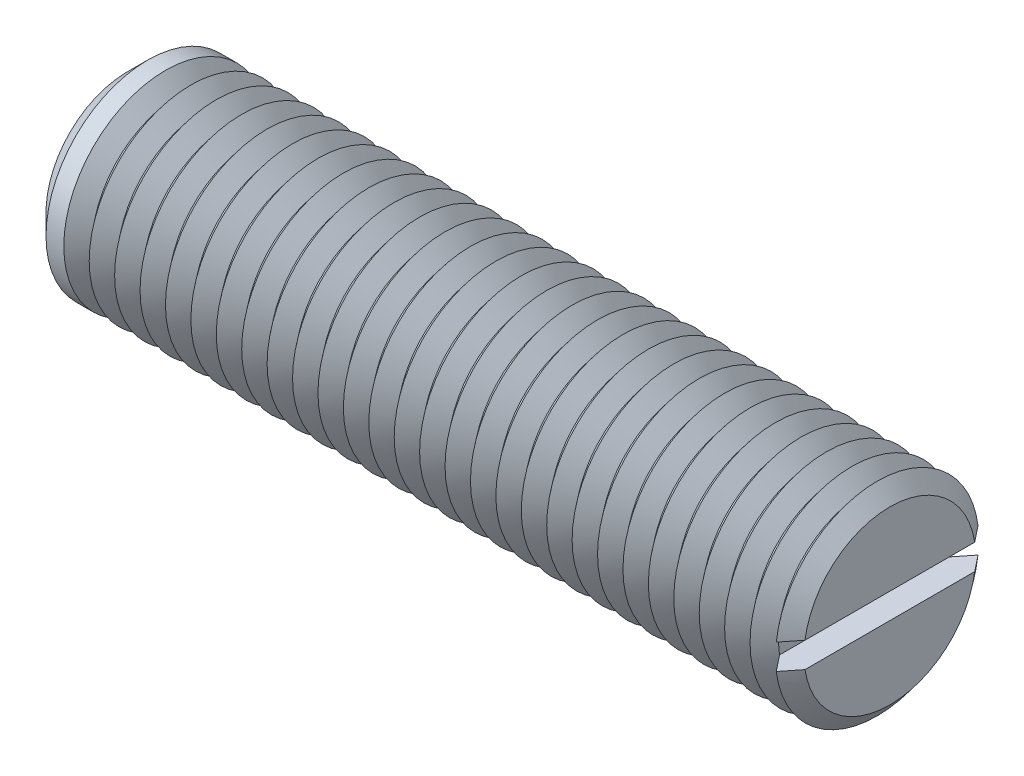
SolidWorks part; units mm, degrees
ref_plane "Front Plane" through (0, 0, 0) normal (0, 0, 1) x (1, 0, 0)
ref_plane "Top Plane" through (0, 0, 0) normal (0, 1, 0) x (1, 0, 0)
ref_plane "Right Plane" through (0, 0, 0) normal (1, 0, 0) x (0, 0, -1)
sketch "Sketch1" plane through (0, 0, 0) normal (1, 0, 0) x (0, 0, -1)
  circle A0 centre (0, 0) radius 8
  dimension "D1" = 16
extrude "Extrude1" add sketch "Sketch1" along normal mid plane 60
sketch "Sketch2" plane through (0, 0, 0) normal (0, 0, 1) x (1, 0, 0)
  line L0 (30, 1) -> (28, 1)
  line L1 (30, -8) -> (30, 8) construction
  line L2 (28, 1) -> (28, -1)
  line L3 (0, 0) -> (50000, 0) construction
  line L4 (30, -1) -> (28, -1)
  line L5 (30, -1) -> (30, 1)
  point P9 (28, 0)
  dimension "D1" = 2
extrude "Extrude2" cut sketch "Sketch2" against normal mid plane 24
chamfer "Chamfer1" distance 1.6 angle 45 1 edges at (-30, 0, -8)
sketch "Sketch3" plane through (0, 0, 0) normal (0, 0, 1) x (1, 0, 0)
  line L0 (0, 0) -> (30.9602, 0) construction
  line L1 (29, -8) -> (31, -8)
  line L2 (-28.4, -8) -> (30, -8) construction
  line L3 (31, -8) -> (30, -6.751)
  line L4 (30, -8) -> (30, -1) construction
  line L5 (30, -6.751) -> (29, -8)
  dimension "D1" = 2
  dimension "D2" = 1.6
revolve "Cut-Revolve1" cut sketch "Sketch3" angle 360 about L0
pattern_linear "LPattern1" count 29 spacing 2 along (-1, 0, 0) of "Cut-Revolve1"
equation "\"D2@Sketch3\" = \"D1@Sketch3\"*0.8"
